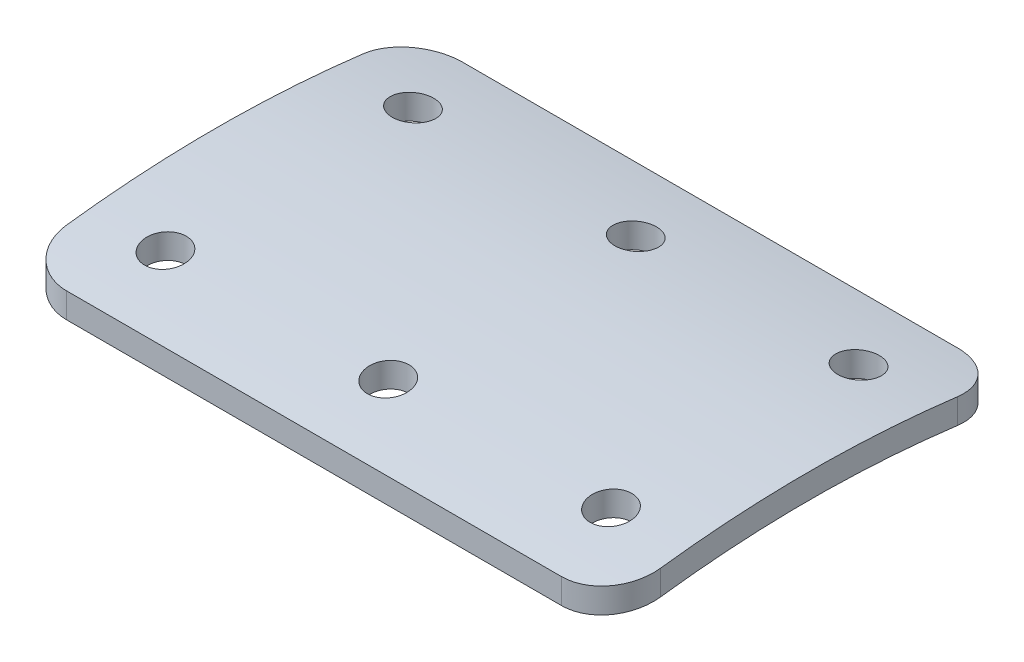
SolidWorks part; units mm, degrees
ref_plane "Front Plane" through (0, 0, 0) normal (0, 0, 1) x (1, 0, 0)
ref_plane "Top Plane" through (0, 0, 0) normal (0, 1, 0) x (1, 0, 0)
ref_plane "Right Plane" through (0, 0, 0) normal (1, 0, 0) x (0, 0, -1)
sketch "Sketch1" plane through (0, 0, 0) normal (0, 0, 1) x (1, 0, 0)
  line L0 (0, 152.4) -> (499.11, 152.4)
  line L1 (0, 0) -> (0, 152.4)
  line L2 (0, 0) -> (651.51, 0) construction
  line L3 (651.51, 0) -> (0, 0)
  arc A0 (499.11, 152.4) -> (651.51, 0) centre (499.11, 0) cw
  dimension "D4" = 152.4
  dimension "D1" = 499.11
  dimension "D2" = 152.4
  dimension "D3" = 651.51
revolve "Revolve2" add sketch "Sketch1" angle 360 about L2
shell "Shell1" thickness 3.175
sketch "Sketch2" plane through (0, 0, 0) normal (0, 0, 1) x (1, 0, 0)
  line L1 (368.3, -17.4498) -> (603.25, -17.4498)
  line L2 (368.3, -17.4498) -> (368.3, 17.4752)
  line L3 (368.3, 17.4752) -> (603.25, 17.4752)
  line L4 (603.25, -17.4498) -> (603.25, 17.4752)
  line L5 (0, 152.4) -> (0, -152.4) construction
  line L6 (0, 149.225) -> (0, -149.225) construction
  point P6 (0, 0)
  dimension "D1" = 34.925
  dimension "D2" = 368.3
  dimension "D3" = 234.95
  dimension "D4" = 17.4498
extrude "Cut-Extrude1" cut sketch "Sketch2" against normal mid plane 508
sketch "Sketch5" plane through (0, 0, 0) normal (0, 0, 1) x (1, 0, 0)
  line L0 (499.11, -152.4) -> (499.11, 152.4) construction
  line L1 (609.6, -107.95) -> (685.8, -107.95)
  line L2 (609.6, -107.95) -> (609.6, 107.95)
  line L3 (609.6, 107.95) -> (685.8, 107.95)
  line L4 (685.8, -107.95) -> (685.8, 107.95)
  dimension "D1" = 110.49
  dimension "D2" = 76.2
  dimension "D3" = 107.95
  dimension "D4" = 107.95
extrude "Cut-Extrude4" cut sketch "Sketch5" against normal mid plane 304.8
sketch "Sketch7" plane through (609.6, 0, 0) normal (1, 0, 0) x (0, 0, -1)
  circle A0 centre (0, 0) radius 104.9653
  circle A1 centre (0, 0) radius 104.9653 construction
extrude "Boss-Extrude1" add sketch "Sketch7" against normal blind 6.35
sketch "Sketch8" plane through (609.6, 0, 0) normal (1, 0, 0) x (0, 0, -1)
  circle A0 centre (0, 0) radius 82.55
  dimension "D1" = 165.1
extrude "Cut-Extrude5" cut sketch "Sketch8" against normal blind 6.35
sketch "Sketch9" plane through (609.6, 0, 0) normal (1, 0, 0) x (0, 0, -1)
  circle A0 centre (95.25, 0) radius 2.54
  dimension "D1" = 5.08
  dimension "D2" = 95.25
extrude "Cut-Extrude6" cut sketch "Sketch9" against normal through all
pattern_circular "CirPattern1" count 6 over 360 about axis through (0, 0, 0) along (1, 0, 0) of "Cut-Extrude6"
sketch "Sketch10" plane through (0, 0, 0) normal (0, 1, 0) x (1, 0, 0)
  line L0 (499.11, -151.3948) -> (499.11, 151.3948) construction
  line L1 (499.11, -25.4) -> (422.91, -25.4)
  line L2 (499.11, -25.4) -> (499.11, 25.4)
  line L3 (499.11, 25.4) -> (422.91, 25.4)
  line L4 (422.91, -25.4) -> (422.91, 25.4)
  dimension "D1" = 50.8
  dimension "D2" = 76.2
  dimension "D3" = 25.4
extrude "Cut-Extrude7" cut sketch "Sketch10" against normal mid plane 508 flip side to cut
sketch "Sketch11" plane through (0, 0, 0) normal (0, 1, 0) x (1, 0, 0)
  line L0 (422.91, 25.4) -> (499.11, 25.4) construction
  line L1 (499.11, -25.4) -> (422.91, -25.4)
  line L2 (499.11, -25.4) -> (499.11, 25.4)
  line L3 (499.11, 25.4) -> (422.91, 25.4)
  line L4 (422.91, -25.4) -> (422.91, 25.4)
  line L5 (422.91, 25.4) -> (422.91, -25.4) construction
extrude "Cut-Extrude8" cut sketch "Sketch11" against normal through all
sketch "Sketch12" plane through (0, 0, 0) normal (0, 1, 0) x (1, 0, 0)
  line L0 (499.11, -25.4) -> (422.91, -25.4) construction
  line L1 (422.91, 25.4) -> (422.91, -25.4) construction
  line L2 (422.91, 25.4) -> (499.11, 25.4) construction
  line L3 (499.11, -25.4) -> (499.11, 25.4) construction
  circle A0 centre (432.435, -15.875) radius 2.667
  circle A1 centre (432.435, 15.875) radius 2.667
  circle A2 centre (461.01, 15.875) radius 2.667
  circle A3 centre (489.585, 15.875) radius 2.667
  circle A4 centre (489.585, -15.875) radius 2.667
  circle A5 centre (461.01, -15.875) radius 2.667
  dimension "D4" = 5.334
  dimension "D5" = 5.334
  dimension "D12" = 5.334
  dimension "D13" = 5.334
  dimension "D11" = 5.334
  dimension "D14" = 5.334
  dimension "D1" = 9.525
  dimension "D2" = 9.525
  dimension "D3" = 9.525
  dimension "D6" = 9.525
  dimension "D7" = 9.525
  dimension "D8" = 9.525
  dimension "D9" = 38.1
  dimension "D10" = 38.1
extrude "Cut-Extrude12" cut sketch "Sketch12" against normal mid plane 508
fillet "Fillet1" radius 6.35 4 edges at (499.11, 148.6579, 25.4) (499.11, 148.6579, -25.4) (422.91, 148.6579, 25.4) (422.91, 148.6579, -25.4)
equation "\"Buoyancy\"= \"SW-Volume\" * ( \"SW-Density\" - .037062 )"
